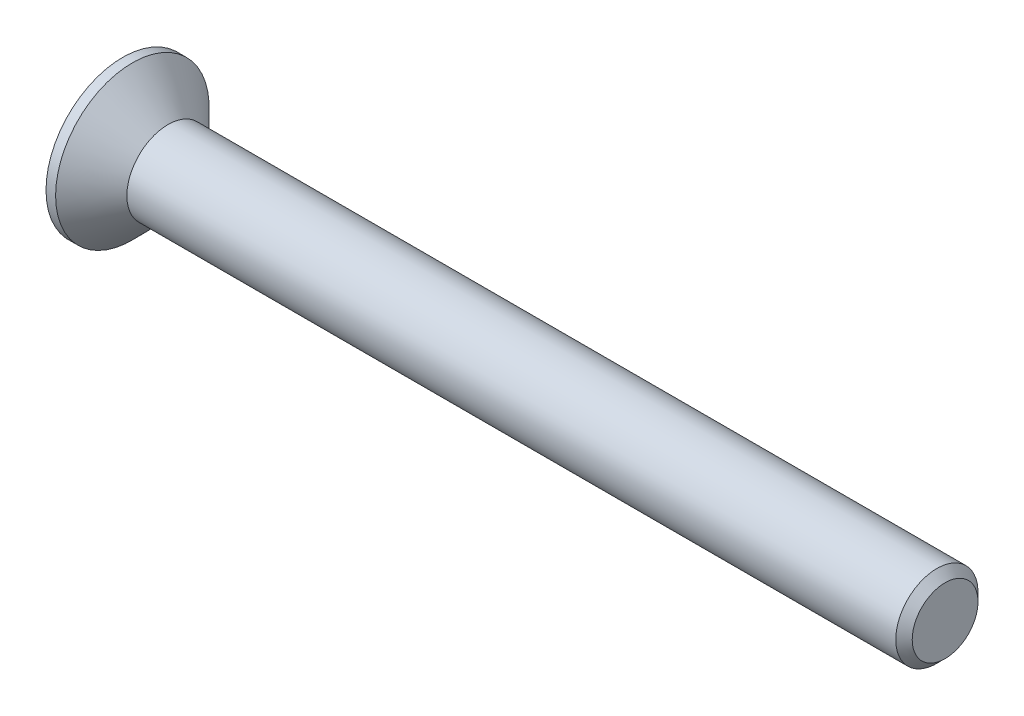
SolidWorks part; units mm, degrees
ref_plane "Front Plane" through (0, 0, 0) normal (0, 0, 1) x (1, 0, 0)
ref_plane "Top Plane" through (0, 0, 0) normal (0, 1, 0) x (1, 0, 0)
ref_plane "Right Plane" through (0, 0, 0) normal (1, 0, 0) x (0, 0, -1)
sketch "Sketch1" plane through (0, 0, 0) normal (0, 0, 1) x (1, 0, 0)
  line L1 (-1.65, 2.8) -> (-1.65, 0)
  line L2 (-1.65, 0) -> (28.35, 0)
  line L3 (28.35, 0) -> (28.35, 1.5)
  line L4 (28.35, 1.5) -> (0, 1.5)
  line L5 (-1.65, 2.8) -> (-1.3, 2.8)
  line L6 (-1.3, 2.8) -> (0, 1.5)
  dimension "D1" = 1.5
  dimension "D2" = 45
  dimension "D3" = 1.65
  dimension "D4" = 30
  dimension "D5" = 2.8
revolve "Revolve1" add sketch "Sketch1" angle 360 about L2
chamfer "Chamfer1" distance 0.3 angle 45 1 edges at (28.35, 0, 1.5)
sketch "Sketch2" plane through (-1.65, 0, 0) normal (-1, 0, 0) x (0, 0, 1)
  line L0 (-0.365, 1.45) -> (0.365, 1.45)
  line L1 (0.365, 1.45) -> (0.365, 0.365)
  line L2 (0.365, 0.365) -> (1.45, 0.365)
  line L3 (1.45, 0.365) -> (1.45, -0.365)
  line L4 (1.45, -0.365) -> (0.365, -0.365)
  line L5 (0.365, -0.365) -> (0.365, -1.45)
  line L6 (0.365, -1.45) -> (-0.365, -1.45)
  line L7 (-0.365, -1.45) -> (-0.365, -0.365)
  line L8 (-0.365, -0.365) -> (-1.45, -0.365)
  line L9 (-1.45, -0.365) -> (-1.45, 0.365)
  line L10 (-1.45, 0.365) -> (-0.365, 0.365)
  line L11 (-0.365, 0.365) -> (-0.365, 1.45)
  point P2 (0, 1.45)
  point P14 (0, -1.45)
  point P15 (1.45, 0)
  point P16 (-1.45, 0)
  dimension "D1" = 2.9
  dimension "D2" = 0.73
extrude "Cut-Extrude1" cut sketch "Sketch2" against normal blind 1.25
